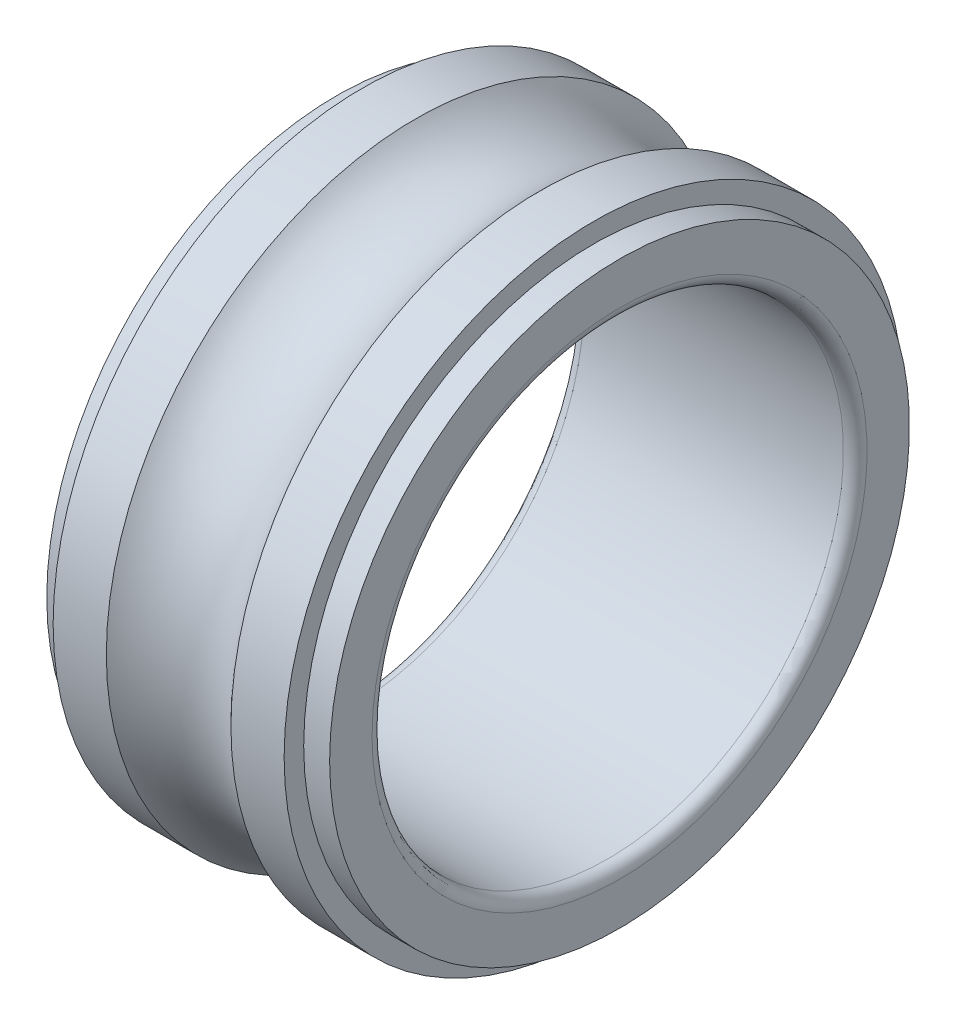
SolidWorks part; units mm, degrees
ref_plane "Face" through (0, 0, 0) normal (0, 0, 1) x (1, 0, 0)
ref_plane "Dessus" through (0, 0, 0) normal (0, 1, 0) x (1, 0, 0)
ref_plane "Droite" through (0, 0, 0) normal (1, 0, 0) x (0, 0, -1)
sketch "Esquisse1" plane through (0, 0, 0) normal (0, 0, 1) x (1, 0, 0)
  line L0 (-24.3202, 0) -> (19.0414, 0) construction
  line L1 (0, 38.0829) -> (0, -29.4105) construction
  line L2 (2.643, 13.13) -> (4.9, 13.13)
  line L4 (-6, 12.3) -> (-6, 10.5)
  line L5 (-5.5, 10) -> (5.5, 10)
  line L6 (6, 12.3) -> (6, 10.5)
  line L7 (-4.9, 13.13) -> (-2.643, 13.13)
  line L9 (-4.9, 13.13) -> (-4.9, 12.3)
  line L10 (-4.9, 12.3) -> (-6, 12.3)
  line L12 (4.9, 12.3) -> (6, 12.3)
  line L13 (4.9, 13.13) -> (4.9, 12.3)
  arc A0 (-2.643, 13.13) -> (2.643, 13.13) centre (0, 15.5) ccw
  arc A1 (-6, 10.5) -> (-5.5, 10) centre (-5.5, 10.5) ccw
  arc A2 (5.5, 10) -> (6, 10.5) centre (5.5, 10.5) ccw
  dimension "D4" = 7.1
  dimension "D6" = 0.5
  dimension "D1" = 20
  dimension "D2" = 12
  dimension "D3" = 15.5
  dimension "D5" = 1.18
  dimension "D7" = 24.6
  dimension "D8" = 1.1
revolve "Base-Révolution" add sketch "Esquisse1" angle 360 about L0
